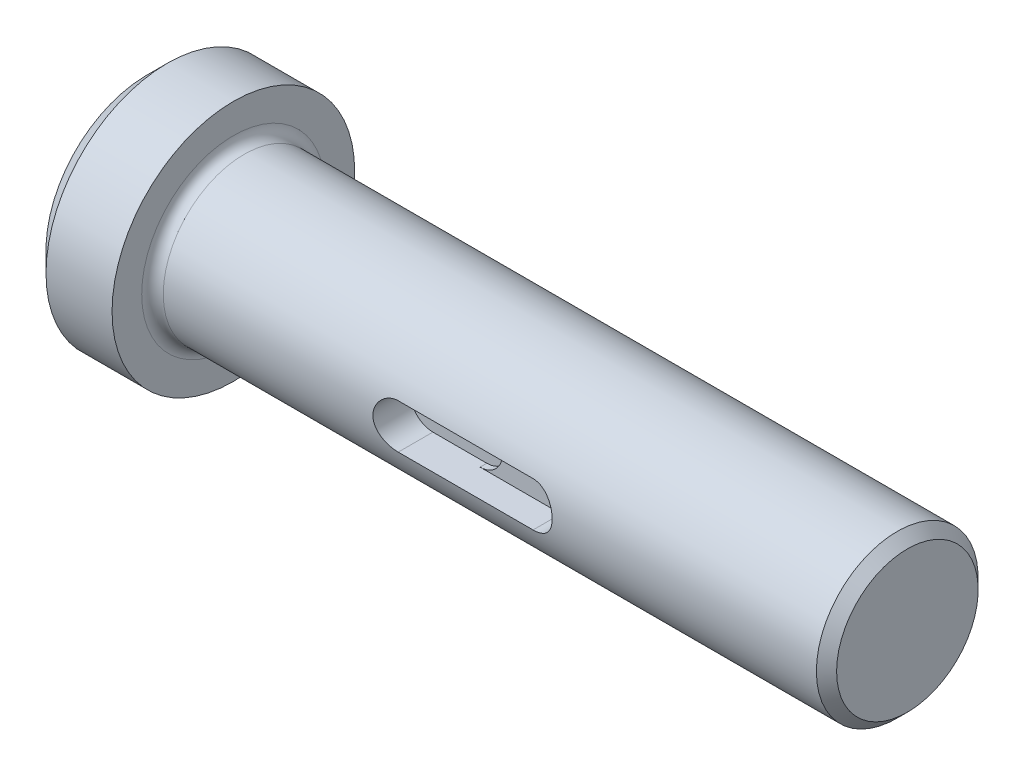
SolidWorks part; units mm, degrees
ref_plane "Front" through (0, 0, 0) normal (0, 0, 1) x (1, 0, 0)
ref_plane "Top" through (0, 0, 0) normal (0, 1, 0) x (1, 0, 0)
ref_plane "Right" through (0, 0, 0) normal (1, 0, 0) x (0, 0, -1)
other "Configuration Table"
sketch "Sketch2" plane through (0, 0, 0) normal (0, 0, 1) x (1, 0, 0)
  line L0 (-56.0675, 0) -> (68.4436, 0) construction
  line L1 (0, 0) -> (0, 9)
  line L2 (0, 9) -> (6.4, 9)
  line L3 (6.4, 9) -> (6.4, 6.8)
  line L4 (7.2, 6) -> (56.4, 6)
  line L5 (56.4, 6) -> (56.4, 0)
  line L6 (56.4, 0) -> (0, 0)
  arc A0 (7.2, 6) -> (6.4, 6.8) centre (7.2, 6.8) cw
revolve "Base" add sketch "Sketch2" angle 360 about L0
chamfer "HeadChamfer" distance 1.5 angle 45 1 edges at (0, 0, 9)
ref_plane "Plane1" through (0, 0, 6) normal (0, 0, 1) x (1, 0, 0)
sketch "Sketch3" plane through (0, 0, 6) normal (0, 0, 1) x (1, 0, 0)
  line L0 (0, 0) -> (53.5043, 0) construction
  line L2 (24.4, 1.65) -> (34.4, 1.65)
  line L3 (34.4, -1.65) -> (24.4, -1.65)
  line L6 (6.4, -9) -> (6.4, 9) construction
  arc A0 (34.4, 1.65) -> (34.4, -1.65) centre (34.4, 0) cw
  arc A1 (24.4, -1.65) -> (24.4, 1.65) centre (24.4, 0) cw
  dimension "n" = 3.3
  dimension "l1" = 18
  dimension "l2" = 10
extrude "Cut-Extrude1" cut sketch "Sketch3" against normal blind 2.3
sketch "Sketch4" plane through (0, 0, 6) normal (0, 0, 1) x (1, 0, 0)
  line L4 (24.4, 1.65) -> (34.4, 1.65) construction
  line L5 (34.4, -1.65) -> (24.4, -1.65) construction
  line L6 (24.4, 1.65) -> (28.4, 1.65)
  line L7 (28.4, -1.65) -> (24.4, -1.65)
  arc A0 (28.4, -1.65) -> (28.4, 1.65) centre (28.4, 0) ccw
  arc A1 (24.4, 1.65) -> (24.4, -1.65) centre (24.4, 0) ccw construction
  arc A2 (24.4, 1.65) -> (24.4, -1.65) centre (24.4, 0) ccw
  dimension "l3" = 4
extrude "Cut-Extrude2" cut sketch "Sketch4" against normal blind 2.8
chamfer "BodyChamfer" distance 0.75 angle 45 1 edges at (56.4, 0, 6)
sketch "Sketch5" plane through (0, 0, 0) normal (0, 0, 1) x (1, 0, 0)
  line L0 (54.1917, 7.4583) -> (55.65, 7.4583)
  line L1 (55.65, 7.4583) -> (55.65, 6)
  line L2 (55.65, 6) -> (54.9208, 4.737)
  line L3 (54.9208, 4.737) -> (54.1917, 6)
  line L4 (54.1917, 6) -> (54.1917, 7.4583)
  line L6 (55.65, 6) -> (7.2, 6) construction
  line L7 (55.65, 6) -> (55.65, -6) construction
revolve "Cut-Revolve10" [suppressed] cut sketch "Sketch5" angle 360 about axis through (-56.0675, 0, 0) along (1, 0, 0)
pattern_linear "LPattern10" [suppressed] count 8 along (1, 0, 0)
equation "\"D1@Plane1\" = \"d@Sketch2\" / 2"
equation "\"D1@BodyChamfer\" = \"c@HeadChamfer\" / 2"
equation "\"D1@Sketch5\" = \"pitch@LPattern10\" / 1.2"
equation "\"D1@LPattern10\" = ( \"b@ThreadCosmetic1\"  - \"D1@BodyChamfer\")/  \"pitch@LPattern10\""
